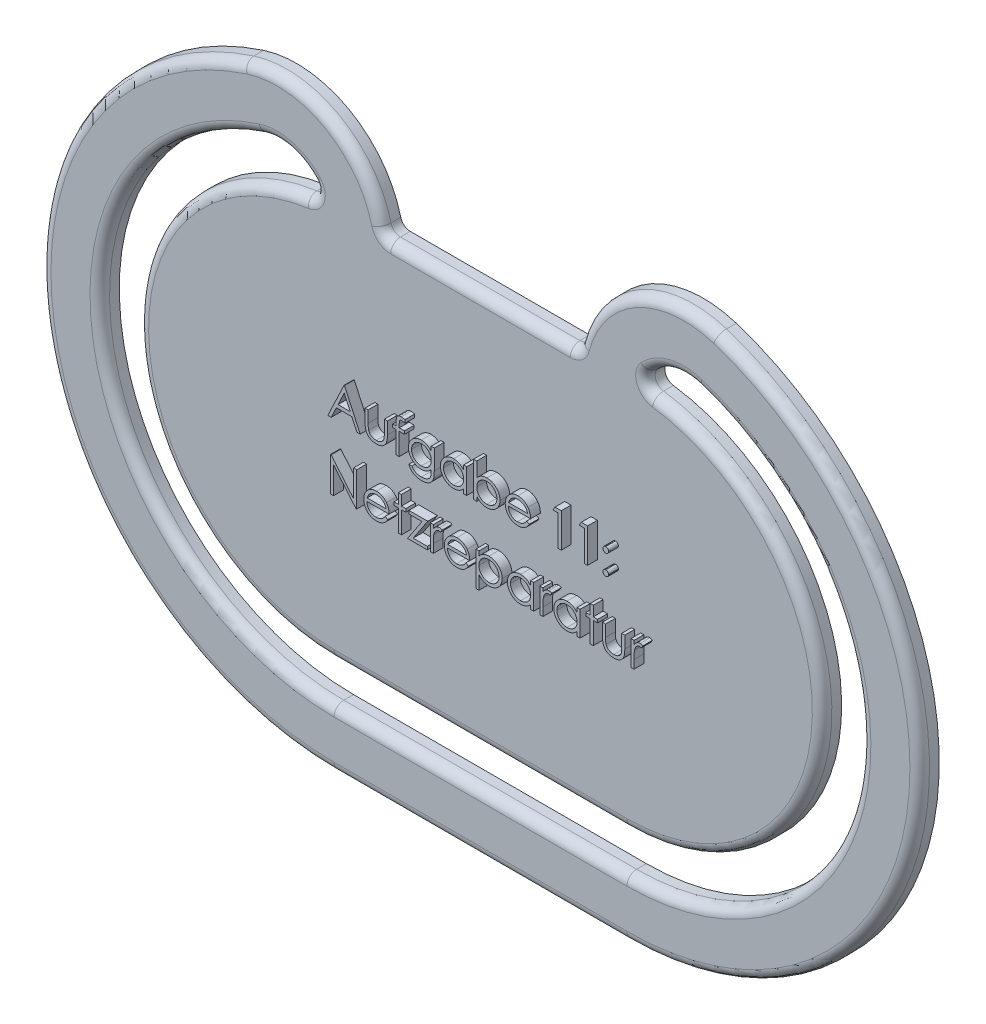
SolidWorks part; units mm, degrees
ref_plane "Ebene vorne" through (0, 0, 0) normal (0, 0, 1) x (1, 0, 0)
ref_plane "Ebene oben" through (0, 0, 0) normal (0, 1, 0) x (1, 0, 0)
ref_plane "Ebene rechts" through (0, 0, 0) normal (1, 0, 0) x (0, 0, -1)
sketch "Skizze1" plane through (0, 0, 0) normal (0, 0, 1) x (1, 0, 0)
  line L0 (-15, 0) -> (15, 0) construction
  line L1 (55, 0) -> (-55, 0) construction
  line L3 (-15, -20) -> (15, -20)
  line L4 (0, -27.2049) -> (0, 37.6994) construction
  line L5 (0, -55) -> (0, 55) construction
  line L6 (-15, 0) -> (15, 0) construction
  line L7 (-10, 20) -> (10, 20)
  line L8 (-15, -24) -> (15, -24)
  line L9 (-15, 0) -> (15, 0) construction
  line L11 (-15, -30) -> (15, -30)
  arc A0 (-16.199, 19.964) -> (-15, -20) centre (-15, 0) ccw
  arc A1 (15, -20) -> (16.199, 19.964) centre (15, 0) ccw
  arc A2 (-22.3663, 22.8416) -> (-15, -24) centre (-15, 0) ccw
  arc A3 (15, -24) -> (22.3663, 22.8416) centre (15, 0) ccw
  arc A4 (-24.2079, 28.552) -> (-15, -30) centre (-15, 0) ccw
  arc A5 (15, -30) -> (24.2079, 28.552) centre (15, 0) ccw
  arc A6 (-16.199, 19.964) -> (-22.3663, 22.8416) centre (-20.8317, 18.0829) ccw
  arc A7 (-10, 20) -> (-24.2079, 28.552) centre (-20.8317, 18.0829) ccw
  arc A8 (22.3663, 22.8416) -> (16.199, 19.964) centre (20.8317, 18.0829) ccw
  arc A9 (24.2079, 28.552) -> (10, 20) centre (20.8317, 18.0829) ccw
  point P5 (0, 0)
  point P14 (0, 0)
  point P21 (0, 0)
  dimension "D3" = 6
  dimension "D4" = 4
  dimension "D5" = 5
  dimension "D6" = 5
  dimension "D7" = 6
  dimension "D8" = 20
  dimension "D9" = 4
  dimension "D11" = 20
  dimension "D2" = 30
  dimension "D10" = 6
  dimension "D12" = 6.199
extrude "Aufsatz-Linear austragen1" add sketch "Skizze1" along normal blind 2
fillet "Verrundung1" radius 1 4 edges at (-10, 20, 1) (10, 20, 1) (-16.199, 19.964, 1) (16.199, 19.964, 1)
fillet "Verrundung2" radius 1 18 edges at (-15.494, 27.7011, 2) (-9.8068, 20.2116, 2) (0, 20, 2) (9.8068, 20.2116, 2) (15.494, 27.7011, 2) (44.6358, -4.6605, 2) (0, -30, 2) (-19.565, 22.9198, 2) (-34.9522, -1.3821, 2) (0, -20, 2) (34.9522, -1.3821, 2) (19.565, 22.9198, 2) (38.7086, -3.7284, 2) (0, -24, 2) (-44.6358, -4.6605, 2) (-38.7086, -3.7284, 2) (-16.9538, 20.4631, 2) (16.9538, 20.4631, 2)
sketch "Skizze2" plane through (0, 0, 2) normal (0, 0, 1) x (1, 0, 0)
  text T0 "Aufgabe 11:  Netzreparatur  "
extrude "Aufsatz-Linear austragen2" add sketch "Skizze2" along normal blind 1
